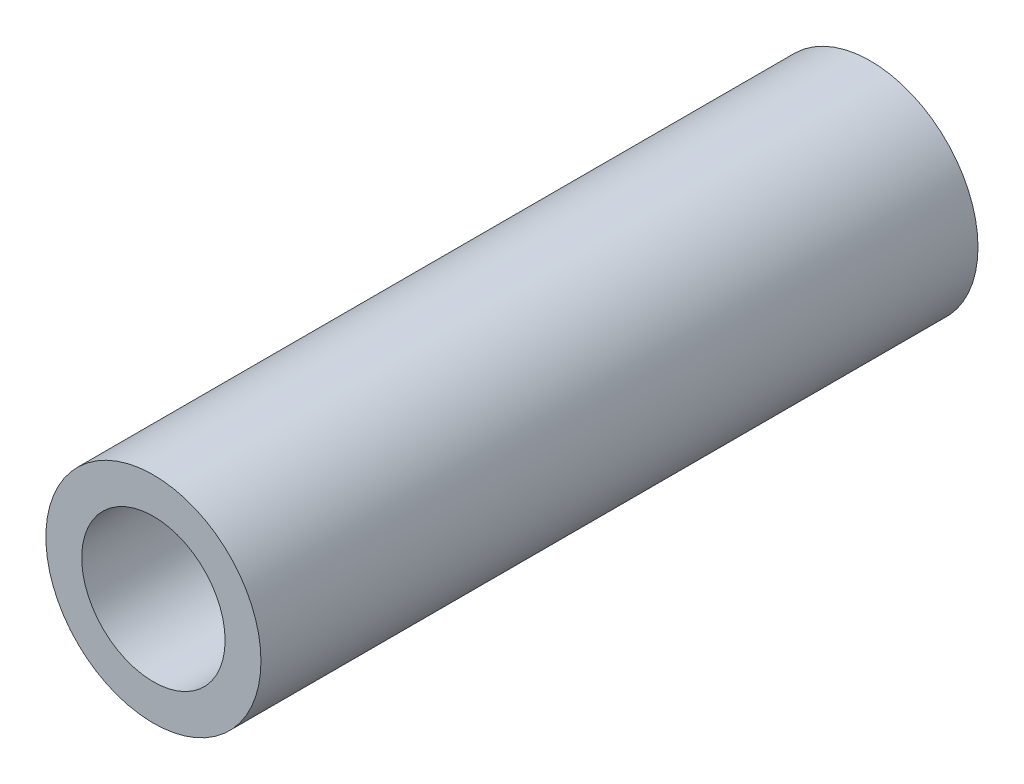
SolidWorks part; units mm, degrees
ref_plane "Płaszczyzna przednia" through (0, 0, 0) normal (0, 0, 1) x (1, 0, 0)
ref_plane "Płaszczyzna górna" through (0, 0, 0) normal (0, 1, 0) x (1, 0, 0)
ref_plane "Płaszczyzna prawa" through (0, 0, 0) normal (1, 0, 0) x (0, 0, -1)
sketch "Szkic1" plane through (0, 0, 0) normal (0, 0, 1) x (1, 0, 0)
  circle A0 centre (0, 0) radius 7.5
  circle A1 centre (0, 0) radius 5
  dimension "D1" = 15
  dimension "D2" = 10
extrude "Dodanie-wyciągnięcie1" add sketch "Szkic1" along normal blind 50
